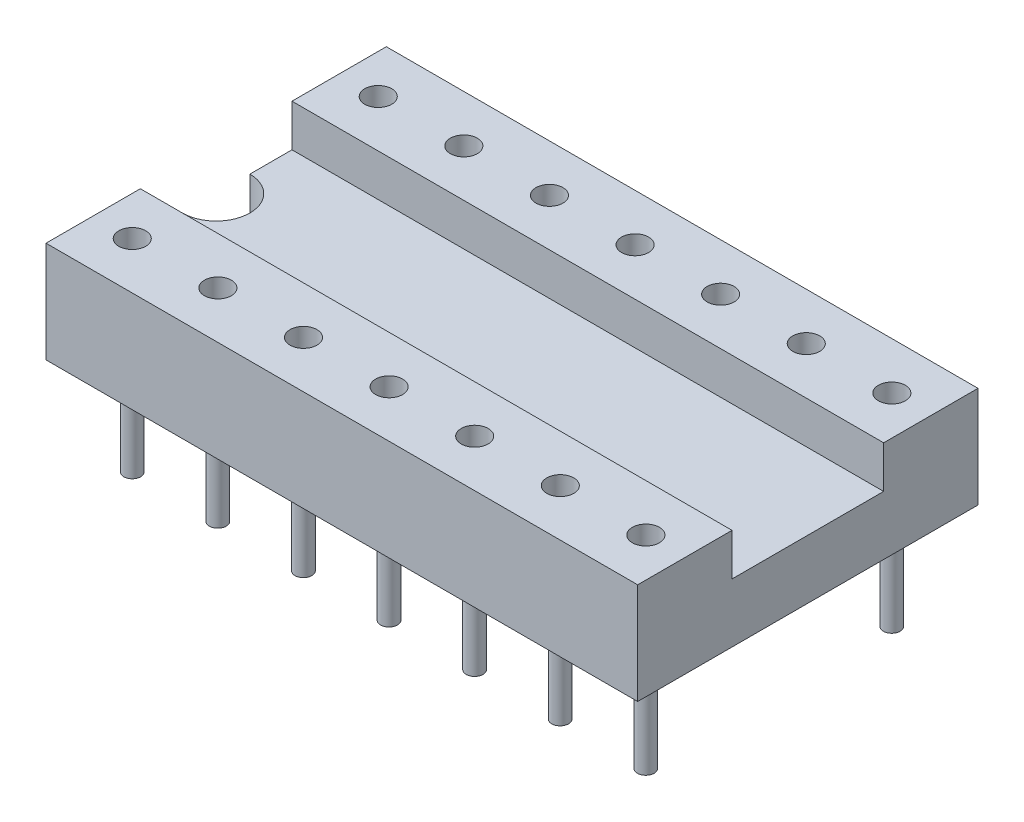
SolidWorks part; units mm, degrees
ref_plane "Plan de face" through (0, 0, 0) normal (0, 0, 1) x (1, 0, 0)
ref_plane "Plan de dessus" through (0, 0, 0) normal (0, 1, 0) x (1, 0, 0)
ref_plane "Plan de droite" through (0, 0, 0) normal (1, 0, 0) x (0, 0, -1)
sketch "Esquisse1" plane through (0, 0, 0) normal (1, 0, 0) x (0, 0, -1)
  line L0 (12.2051, 0) -> (-23.3437, 0) construction
  line L1 (0, -4.6214) -> (0, 25.9507) construction
  line L2 (-5.7968, 1.75) -> (2.763, 1.75) construction
  line L3 (5.7565, 3) -> (-6.8307, 3) construction
  line L4 (5.05, 3.8077) -> (5.05, -1.0493) construction
  line L5 (-5.05, 3.7235) -> (-5.05, -1.0493) construction
  line L6 (-2.25, 3.5071) -> (-2.25, 0.8142) construction
  line L7 (2.25, 3.5071) -> (2.25, 0.8142) construction
  line L8 (-2.25, 1.75) -> (-2.25, 3)
  line L9 (-2.25, 3) -> (-5.05, 3)
  line L10 (-5.05, 3) -> (-5.05, 0)
  line L11 (-5.05, 0) -> (5.05, 0)
  line L12 (5.05, 0) -> (5.05, 3)
  line L13 (5.05, 3) -> (2.25, 3)
  line L14 (2.25, 3) -> (2.25, 1.75)
  line L15 (2.25, 1.75) -> (-2.25, 1.75)
  dimension "D1" = 1.75
  dimension "D2" = 3
  dimension "D3" = 5.05
  dimension "D4" = 5.05
  dimension "D5" = 2.8
  dimension "D6" = 2.8
extrude "Extrusion1" add sketch "Esquisse1" along normal blind 17.56
sketch "Esquisse2" plane through (0, 1.75, 0) normal (0, 1, 0) x (-1, 0, 0)
  line L0 (0, -1) -> (0, 1)
  arc A0 (0, 1) -> (0, -1) centre (0, 0) ccw
extrude "Enlèv. mat.-Extru.1" cut sketch "Esquisse2" against normal through all
sketch "Esquisse3" plane through (0, 3, 0) normal (0, 1, 0) x (-1, 0, 0)
  line L0 (-13.1576, 5.05) -> (2.3638, 5.05) construction
  line L1 (0, 6.1465) -> (0, -6.3771) construction
  line L2 (1.5124, 0) -> (-12.9979, 0) construction
  line L3 (1.0512, 3.65) -> (-15.6055, 3.65) construction
  line L4 (-1.16, 6.2884) -> (-1.16, 1.7827) construction
  circle A0 centre (-1.16, 3.65) radius 0.4
  circle A1 centre (-1.16, -3.65) radius 0.4
  circle A2 centre (-3.701, 3.65) radius 0.4
  circle A3 centre (-3.701, -3.65) radius 0.4
  circle A4 centre (-6.242, 3.65) radius 0.4
  circle A5 centre (-6.242, -3.65) radius 0.4
  circle A6 centre (-8.783, 3.65) radius 0.4
  circle A7 centre (-8.783, -3.65) radius 0.4
  circle A8 centre (-11.323, 3.65) radius 0.4
  circle A9 centre (-11.323, -3.65) radius 0.4
  circle A10 centre (-13.863, 3.65) radius 0.4
  circle A11 centre (-13.863, -3.65) radius 0.4
  circle A12 centre (-16.403, 3.65) radius 0.4
  circle A13 centre (-16.403, -3.65) radius 0.4
  dimension "D1" = 1.4
  dimension "D2" = 1.16
extrude "Enlèv. mat.-Extru.2" cut sketch "Esquisse3" against normal blind 2.5
sketch "Esquisse5" plane through (0, 0, 0) normal (0, -1, 0) x (1, 0, 0)
  line L0 (-0.4263, 0) -> (10.6481, 0) construction
  circle A0 centre (1.16, 3.65) radius 0.25
  circle A1 centre (1.16, -3.65) radius 0.25
  circle A2 centre (3.7, -3.65) radius 0.25
  circle A3 centre (3.7, 3.65) radius 0.25
  circle A4 centre (6.24, -3.65) radius 0.25
  circle A5 centre (6.24, 3.65) radius 0.25
  circle A6 centre (8.78, -3.65) radius 0.25
  circle A7 centre (8.78, 3.65) radius 0.25
  circle A8 centre (11.32, -3.65) radius 0.25
  circle A9 centre (11.32, 3.65) radius 0.25
  circle A10 centre (13.86, -3.65) radius 0.25
  circle A11 centre (13.86, 3.65) radius 0.25
  circle A12 centre (16.4, -3.65) radius 0.25
  circle A13 centre (16.4, 3.65) radius 0.25
extrude "Extrusion2" add sketch "Esquisse5" along normal blind 3
